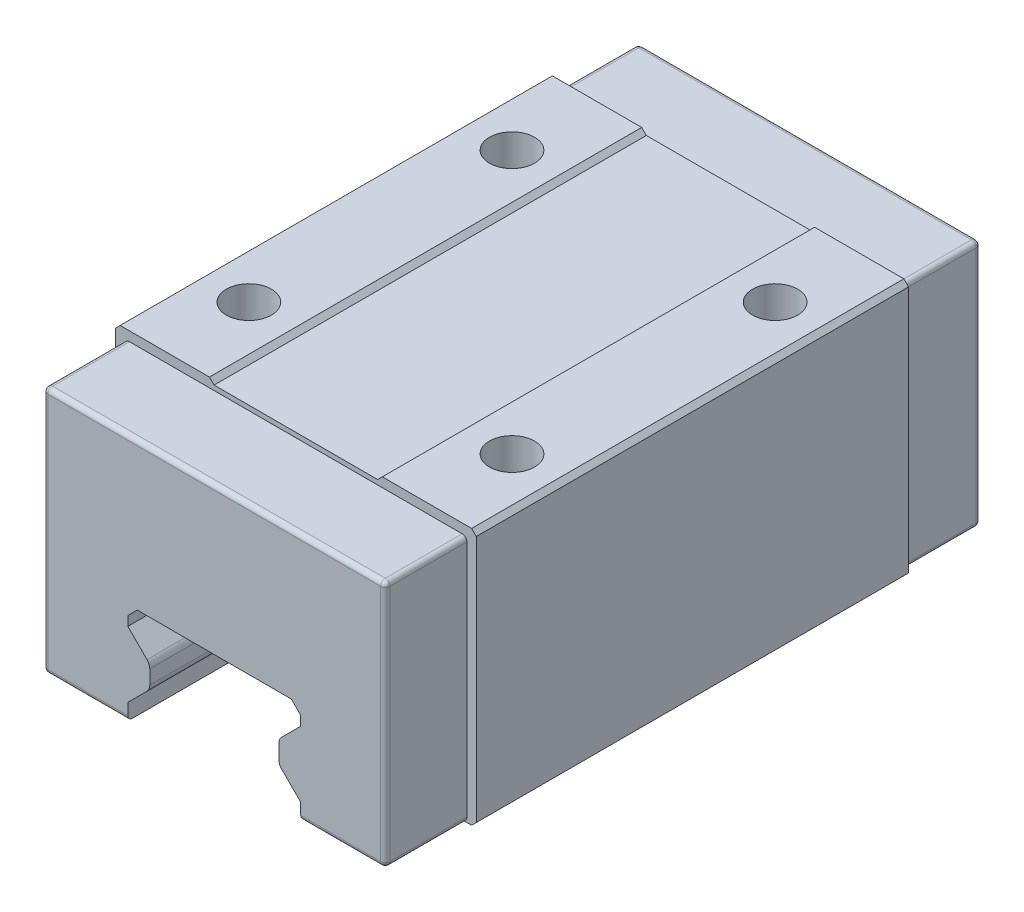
SolidWorks part; units mm, degrees
ref_plane "Front Plane" through (0, 0, 0) normal (0, 0, 1) x (1, 0, 0)
ref_plane "Top Plane" through (0, 0, 0) normal (0, 1, 0) x (1, 0, 0)
ref_plane "Right Plane" through (0, 0, 0) normal (1, 0, 0) x (0, 0, -1)
sketch "Sketch1" plane through (0, 0, 0) normal (0, 0, 1) x (1, 0, 0)
  line L1 (-24, 5.8) -> (24, 5.8)
  line L2 (-24, 5.8) -> (-24, 40)
  line L3 (-24, 40) -> (24, 40)
  line L4 (24, 5.8) -> (24, 40)
  line L5 (-24, 5.8) -> (24, 40) construction
  line L6 (-24, 40) -> (24, 5.8) construction
  point P0 (0, 22.9)
  dimension "D1" = 40
  dimension "D2" = 5.8
  dimension "D3" = 48
extrude "Boss-Extrude1" add sketch "Sketch1" along normal mid plane 57.5
sketch "Sketch2" plane through (0, 0, 0) normal (0, 0, 1) x (1, 0, 0)
  line L0 (-24, 5.8) -> (24, 5.8) construction
  line L1 (-22.75, 5.8) -> (22.75, 5.8)
  line L2 (-22.75, 5.8) -> (-22.75, 38.75)
  line L3 (-22.75, 38.75) -> (22.75, 38.75)
  line L4 (22.75, 5.8) -> (22.75, 38.75)
  line L5 (-22.75, 38.75) -> (-24, 38.75) construction
  line L6 (-24, 40) -> (-24, 5.8) construction
  line L7 (22.75, 38.75) -> (22.75, 40) construction
  line L8 (24, 40) -> (-24, 40) construction
  line L9 (22.75, 38.75) -> (24, 38.75) construction
  line L10 (24, 5.8) -> (24, 40) construction
  point P9 (0, 38.75)
  dimension "D1" = 1.25
extrude "Boss-Extrude2" add sketch "Sketch2" along normal mid plane 79.2
sketch "Sketch3" plane through (0, 0, 39.6) normal (0, 0, 1) x (1, 0, 0)
  line L1 (-11.5, 19.2) -> (11.5, 19.2)
  line L2 (-11.5, 19.2) -> (-11.5, 0)
  line L3 (-11.5, 0) -> (11.5, 0)
  line L4 (11.5, 19.2) -> (11.5, 0)
  line L5 (-11.5, 19.2) -> (11.5, 0) construction
  line L6 (-11.5, 0) -> (11.5, 19.2) construction
  point P0 (0, 9.6)
  dimension "D1" = 23
  dimension "D2" = 19.2
extrude "Cut-Extrude1" cut sketch "Sketch3" against normal through all
sketch "Sketch4" plane through (0, 0, 39.6) normal (0, 0, 1) x (1, 0, 0)
  line L0 (-11.5, 16.7) -> (-11.5, 7.95)
  line L1 (-11.5, 19.2) -> (-11.5, 5.8) construction
  line L2 (-11.5, 7.95) -> (-8.5833, 10.8667)
  line L3 (-8.5833, 10.8667) -> (-8.5833, 13.7833)
  line L4 (-8.5833, 13.7833) -> (-11.5, 16.7)
  line L5 (11.5, 19.2) -> (-11.5, 19.2) construction
  line L6 (-8.5833, 13.7833) -> (-11.5, 13.7833) construction
  line L7 (-8.5833, 10.8667) -> (-11.5, 10.8667) construction
  line L8 (-10.0417, 13.7833) -> (-10.0417, 10.8667) construction
  line L9 (0, 0) -> (0, 19.2) construction
  line L10 (10.0417, 13.7833) -> (10.0417, 10.8667) construction
  line L11 (8.5833, 10.8667) -> (11.5, 10.8667) construction
  line L12 (8.5833, 13.7833) -> (11.5, 13.7833) construction
  line L13 (8.5833, 13.7833) -> (11.5, 16.7)
  line L14 (8.5833, 10.8667) -> (8.5833, 13.7833)
  line L15 (11.5, 7.95) -> (8.5833, 10.8667)
  line L16 (11.5, 16.7) -> (11.5, 7.95)
extrude "Boss-Extrude3" add sketch "Sketch4" against normal up to surface (79.2 mm away)
chamfer "Chamfer1" distance 1.25 angle 45 2 edges at (11.5, 19.2, 0) (-11.5, 19.2, 0)
fillet "Fillet1" radius 1.25 4 edges at (8.5833, 10.8667, 0) (8.5833, 13.7833, 0) (-8.5833, 10.8667, 0) (-8.5833, 13.7833, 0)
sketch "Sketch5" plane through (0, 0, 28.75) normal (0, 0, 1) x (1, 0, 0)
  line L0 (24, 40) -> (-24, 40) construction
  line L1 (-11.5, 40) -> (11.5, 40)
  line L2 (-11.5, 40) -> (-11.5, 39.38)
  line L3 (-11.5, 39.38) -> (11.5, 39.38)
  line L4 (11.5, 40) -> (11.5, 39.38)
  point P6 (0, 39.38)
  dimension "D1" = 23
  dimension "D2" = 0.62
extrude "Cut-Extrude2" cut sketch "Sketch5" against normal through all
chamfer "Chamfer2" distance 0.62 angle 45 6 edges at (24, 40, 0) (24, 5.8, 0) (-24, 5.8, 0) (-24, 40, 0) (11.5, 39.38, 0) (-11.5, 39.38, 0)
fillet "Fillet2" radius 0.62 18 edges at (-22.75, 5.8, -34.175) (17.125, 5.8, -39.6) (-22.75, 5.8, 34.175) (-17.125, 5.8, -39.6) (-17.125, 5.8, 39.6) (17.125, 5.8, 39.6) (22.75, 5.8, 34.175) (-22.75, 22.275, 39.6) (-22.75, 22.275, -39.6) (-22.75, 38.75, 34.175) (22.75, 38.75, 34.175) (22.75, 22.275, 39.6) (22.75, 22.275, -39.6) (0, 38.75, 39.6) (0, 38.75, -39.6) (22.75, 5.8, -34.175) (22.75, 38.75, -34.175) (-22.75, 38.75, -34.175)
sketch "Sketch6" plane through (0, 40, 0) normal (0, 1, 0) x (1, 0, 0)
  line L0 (-17.5, 17.5) -> (0, 0) construction
  line L1 (0, 0) -> (17.5, -17.5) construction
  line L2 (17.5, 17.5) -> (0, 0) construction
  line L3 (0, 0) -> (-17.5, -17.5) construction
  circle A0 centre (-17.5, 17.5) radius 3
  circle A1 centre (-17.5, -17.5) radius 3
  circle A2 centre (17.5, -17.5) radius 3
  circle A3 centre (17.5, 17.5) radius 3
  dimension "D1" = 6
  dimension "D2" = 35
  dimension "D3" = 35
extrude "Cut-Extrude3" cut sketch "Sketch6" against normal blind 9
sketch "Sketch7" plane through (0, 0, 0) normal (0, 0, 1) x (1, 0, 0)
  line L0 (-23.38, 40) -> (-35, 40)
  line L1 (-35, 40) -> (-35, 30)
  line L2 (-23.38, 40) -> (-23.38, 19.62)
  line L3 (-24, 39.38) -> (-24, 6.42) construction
  line L4 (-24, 19.62) -> (-23.38, 19.62)
  line L5 (-35, 30) -> (-34.38, 30)
  line L6 (0, 0) -> (0, 39.38) construction
  line L7 (-10.88, 39.38) -> (10.88, 39.38) construction
  line L8 (35, 30) -> (34.38, 30)
  line L9 (24, 19.62) -> (23.38, 19.62)
  line L10 (23.38, 40) -> (23.38, 19.62)
  line L11 (35, 40) -> (35, 30)
  line L12 (23.38, 40) -> (35, 40)
  arc A1 (-34.38, 30) -> (-24, 19.62) centre (-34.38, 19.62) cw
  arc A2 (34.38, 30) -> (24, 19.62) centre (34.38, 19.62) ccw
  point P22 (-34.69, 30)
  dimension "D1" = 70
  dimension "D2" = 10
  dimension "D3" = 0.62
extrude "Boss-Extrude4" [suppressed] add sketch "Sketch7" along normal mid plane 30
sketch "Sketch8" [suppressed] plane through (0, 0, 0) normal (0, 0, 1) x (1, 0, 0)
  line L5 (-35, 30) -> (-35, 40)
  line L6 (-35, 30) -> (-23.38, 30)
  line L7 (-35, 40) -> (-23.38, 40)
  line L8 (-23.38, 30) -> (-23.38, 40)
  line L9 (35, 30) -> (35, 40)
  line L10 (35, 30) -> (23.38, 30)
  line L11 (35, 40) -> (23.38, 40)
  line L13 (23.38, 40) -> (23.38, 30)
extrude "Boss-Extrude5" [suppressed] add sketch "Sketch8" along normal mid plane 57.5
chamfer "Chamfer3" [suppressed] distance 0.62 angle 45
fillet "Fillet3" [suppressed] radius 6
equation "\"D2@Sketch4\"=\"D1@Sketch4\"*3.5"
